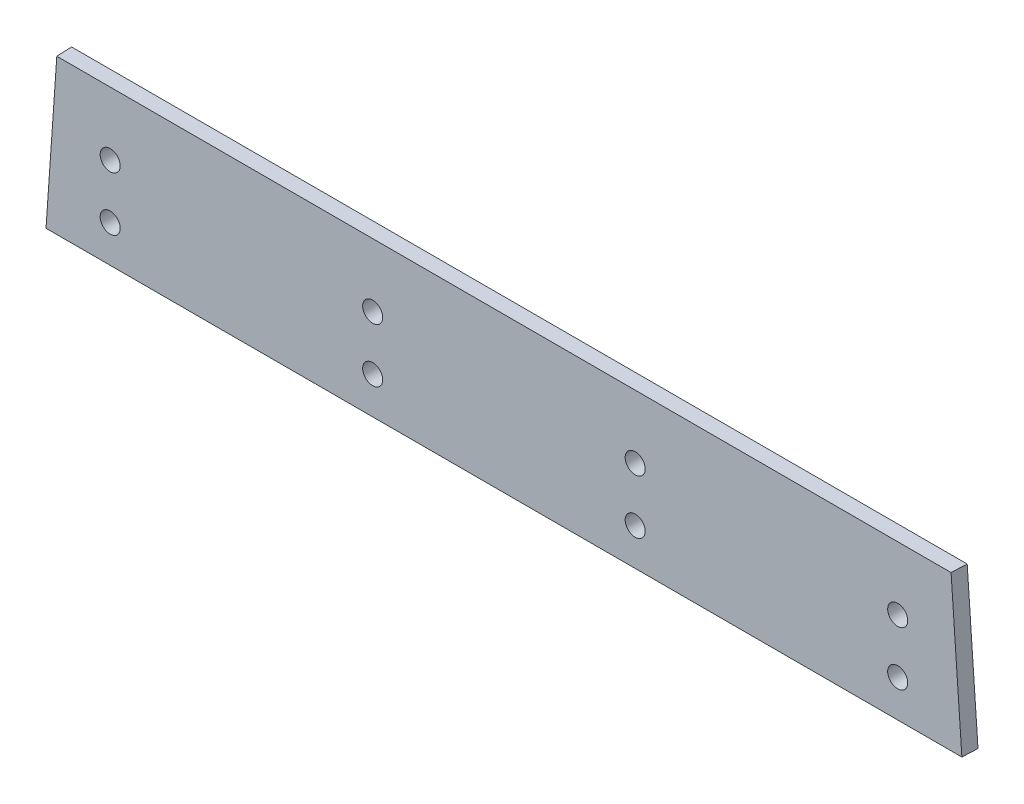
SolidWorks part; units mm, degrees
ref_plane "前视基准面" through (0, 0, 0) normal (0, 0, 1) x (1, 0, 0)
ref_plane "上视基准面" through (0, 0, 0) normal (0, 1, 0) x (1, 0, 0)
ref_plane "右视基准面" through (0, 0, 0) normal (1, 0, 0) x (0, 0, -1)
sketch "草图1" plane through (0, 0, 0) normal (0, 0, 1) x (1, 0, 0)
  line L0 (-290, 0) -> (290, 0)
  line L1 (290, 0) -> (297, -100)
  line L2 (297, -100) -> (-297, -100)
  line L3 (-297, -100) -> (-290, 0)
  dimension "D1" = 580
  dimension "D2" = 594
  dimension "D3" = 290
  dimension "D4" = 297
  dimension "D5" = 100
extrude "拉伸1" add sketch "草图1" along normal blind 10
sketch "草图2" plane through (0, 0, 10) normal (0, 0, 1) x (1, 0, 0)
  line L0 (-318.0316, -76) -> (-161.6721, -76) construction
  line L1 (-337.0563, -41) -> (-134.3241, -41) construction
  line L2 (-297, -100) -> (297, -100) construction
  line L3 (-255, 22.7201) -> (-255, -183.5792) construction
  line L4 (-173.5626, 36.9887) -> (-173.5626, -165.7435) construction
  circle A0 centre (-255, -41) radius 6.5
  circle A1 centre (-255, -76) radius 6.5
  dimension "D4" = 13
  dimension "D5" = 13
  dimension "D1" = 24
  dimension "D2" = 35
  dimension "D3" = 42
extrude "切除-拉伸1" cut sketch "草图2" against normal blind 10
pattern_linear "阵列(线性)1" count 4 spacing 170 along (1, 0, 0) of "切除-拉伸1"
chamfer "倒角1" distance 10 angle 2.5 1 edges at (293.5, -50, 10)
chamfer "倒角2" distance 10 angle 2.5 1 edges at (-293.5, -50, 10)
